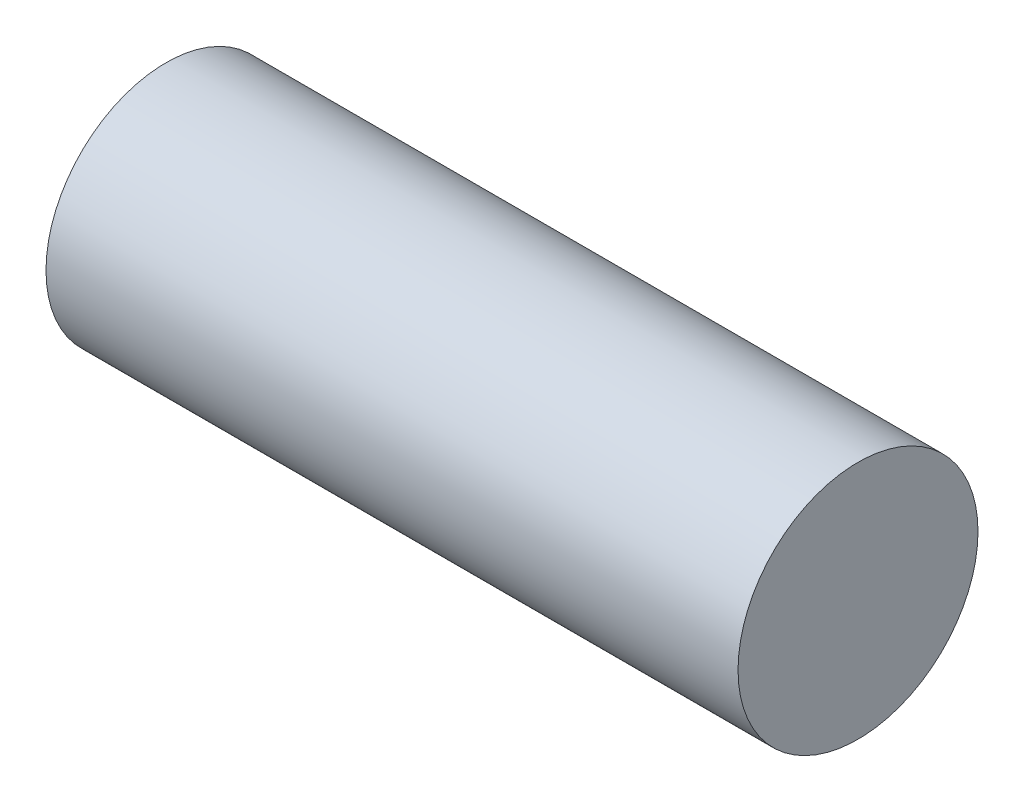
SolidWorks part; units mm, degrees
ref_plane "Vorne" through (0, 0, 0) normal (0, 0, 1) x (1, 0, 0)
ref_plane "Oben" through (0, 0, 0) normal (0, 1, 0) x (1, 0, 0)
ref_plane "Rechts" through (0, 0, 0) normal (1, 0, 0) x (0, 0, -1)
sketch "Skizze1" plane through (0, 0, 0) normal (0, 0, 1) x (1, 0, 0)
  line L0 (0, 0) -> (79.1682, 0) construction
  line L5 (53.5443, 1.7) -> (53.5443, 0) construction
  line L6 (53.5443, 1.7) -> (63.35, 1.7) construction
  line L7 (63.35, 1.7) -> (63.35, 0) construction
  line L8 (53.5443, 0) -> (63.35, 0)
  line L9 (53.5443, 1.7) -> (53.5443, 0)
  line L10 (53.5443, 1.7) -> (63.35, 1.7)
  line L11 (63.35, 1.7) -> (63.35, 0)
revolve "Rotation1" add sketch "Skizze1" angle 360 about L8
